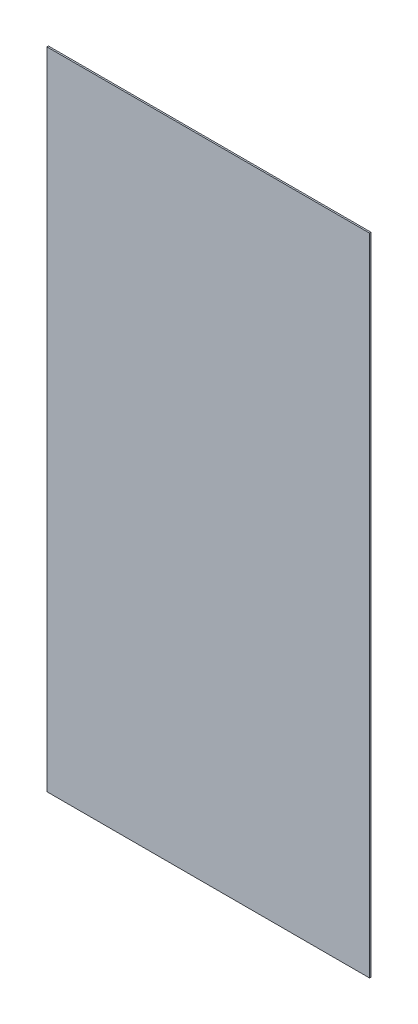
SolidWorks part; units mm, degrees
ref_plane "Front Plane" through (0, 0, 0) normal (0, 0, 1) x (1, 0, 0)
ref_plane "Top Plane" through (0, 0, 0) normal (0, 1, 0) x (1, 0, 0)
ref_plane "Right Plane" through (0, 0, 0) normal (1, 0, 0) x (0, 0, -1)
sketch "Sketch1" plane through (0, 0, 0) normal (0, 0, 1) x (1, 0, 0)
  line L1 (0, 0) -> (609.6, 0)
  line L2 (0, 0) -> (0, 1219.2)
  line L3 (0, 1219.2) -> (609.6, 1219.2)
  line L4 (609.6, 0) -> (609.6, 1219.2)
  dimension "D1" = 609.6
  dimension "D2" = 1219.2
extrude "Boss-Extrude1" add sketch "Sketch1" along normal blind 2.8575
